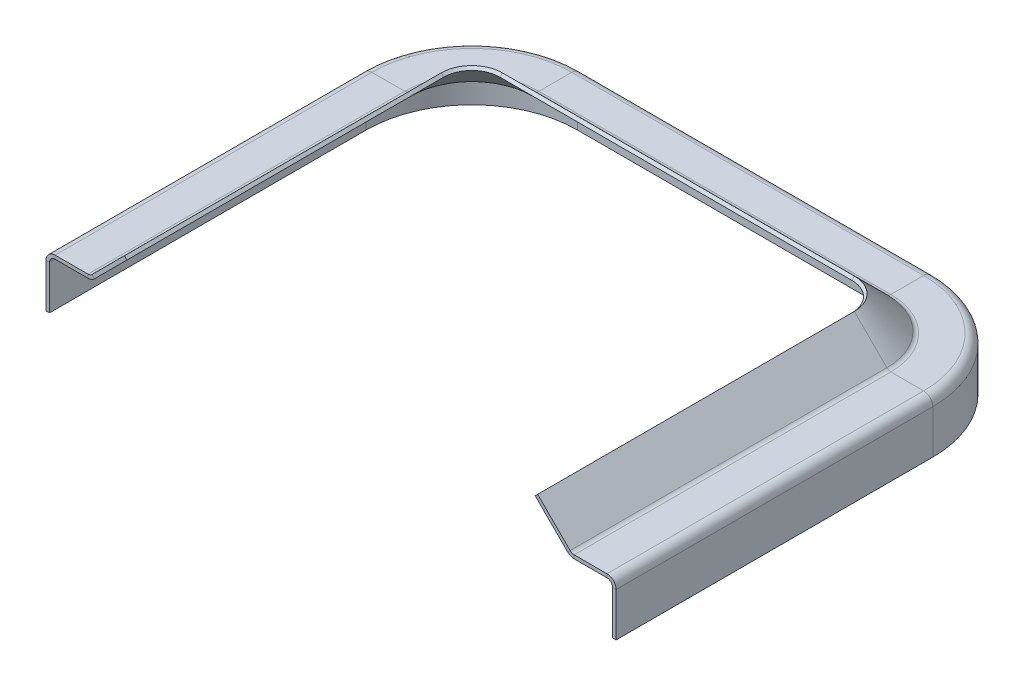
SolidWorks part; units mm, degrees
ref_plane "Front Plane" through (0, 0, 0) normal (0, 0, 1) x (1, 0, 0)
ref_plane "Top Plane" through (0, 0, 0) normal (0, 1, 0) x (1, 0, 0)
ref_plane "Right Plane" through (0, 0, 0) normal (1, 0, 0) x (0, 0, -1)
sketch "Sketch1" plane through (0, 0, 0) normal (0, 0, 1) x (1, 0, 0)
  line L0 (0, 0) -> (0, 35)
  line L1 (0, 35) -> (30, 35)
  line L2 (30, 35) -> (55, 60)
  dimension "D1" = 35
  dimension "D2" = 25
  dimension "D3" = 30
  dimension "D4" = 135
sketch "Sketch2" plane through (0, 0, 0) normal (0, 1, 0) x (1, 0, 0)
  line L0 (0, 0) -> (0, 225)
  line L1 (75, 300) -> (325, 300)
  line L2 (400, 225) -> (400, 0)
  arc A0 (0, 225) -> (75, 300) centre (75, 225) cw
  arc A1 (325, 300) -> (400, 225) centre (325, 225) cw
  dimension "D1" = 400
  dimension "D3" = 75
  dimension "D2" = 300
swept flange "Swept Flange1" thickness 2.5 parameters "D1"=4
other "Sweptbend1_1" parameters "D1"=4, "D4"=315, "D5"=1
other "Sweptbend1_2" parameters "D1"=4, "D4"=90, "D5"=2
other "Sweptbend2_1" parameters "D1"=4, "D4"=270, "D5"=3
other "Sweptbend2_2" parameters "D1"=4, "D4"=270, "D5"=4
sketch "Bend-Lines1" [suppressed] plane through (0, 0, 0) normal (0, 1, 0) x (1, 0, 0)
sketch "Bounding-Box1" [suppressed] plane through (0, 0, 0) normal (0, 1, 0) x (1, 0, 0)
sheet metal parameters "Sheet-Metal1" thickness 2.5 parameters "D1"=4
flat pattern "Flat-Pattern1"
sketch "Bend-Lines2" plane through (0, 0, -300) normal (0, 0, 1) x (1, 0, 0)
  line L0 (464.616, -75) -> (464.616, -300) construction
  line L1 (435.1233, -75) -> (435.1233, -300) construction
  line L2 (21.967, -21.967) -> (-48.2774, 48.2774) construction
  line L3 (378.033, -21.967) -> (448.2774, 48.2774) construction
  line L4 (75, 64.616) -> (325, 64.616) construction
  line L5 (-64.616, -300) -> (-64.616, -75) construction
  line L6 (75, 35.1233) -> (325, 35.1233) construction
  line L7 (-35.1233, -300) -> (-35.1233, -75) construction
  arc A0 (464.616, -75) -> (325, 64.616) centre (325, -75) ccw construction
  arc A4 (75, 64.616) -> (-64.616, -75) centre (75, -75) ccw construction
  arc A5 (435.1233, -75) -> (325, 35.1233) centre (325, -75) ccw construction
  arc A6 (75, 35.1233) -> (-35.1233, -75) centre (75, -75) ccw construction
sketch3d "Bounding-Box2" [suppressed]
  line L0 (68.3406, 174.3406, 0) -> (-530.3406, 174.3406, 0) construction
  line L1 (68.3406, -225, 0) -> (-530.3406, -225, 0) construction
  line L2 (68.3406, 174.3406, 0) -> (68.3406, -225, 0) construction
  line L3 (-530.3406, 174.3406, 0) -> (-530.3406, -225, 0) construction
bend of the flat pattern "Flatten-<Sweptbend1_1>1"
bend of the flat pattern "Flatten-<Sweptbend1_2>1"
bend of the flat pattern "Flatten-<Sweptbend2_1>1"
bend of the flat pattern "Flatten-<Sweptbend2_2>1"
